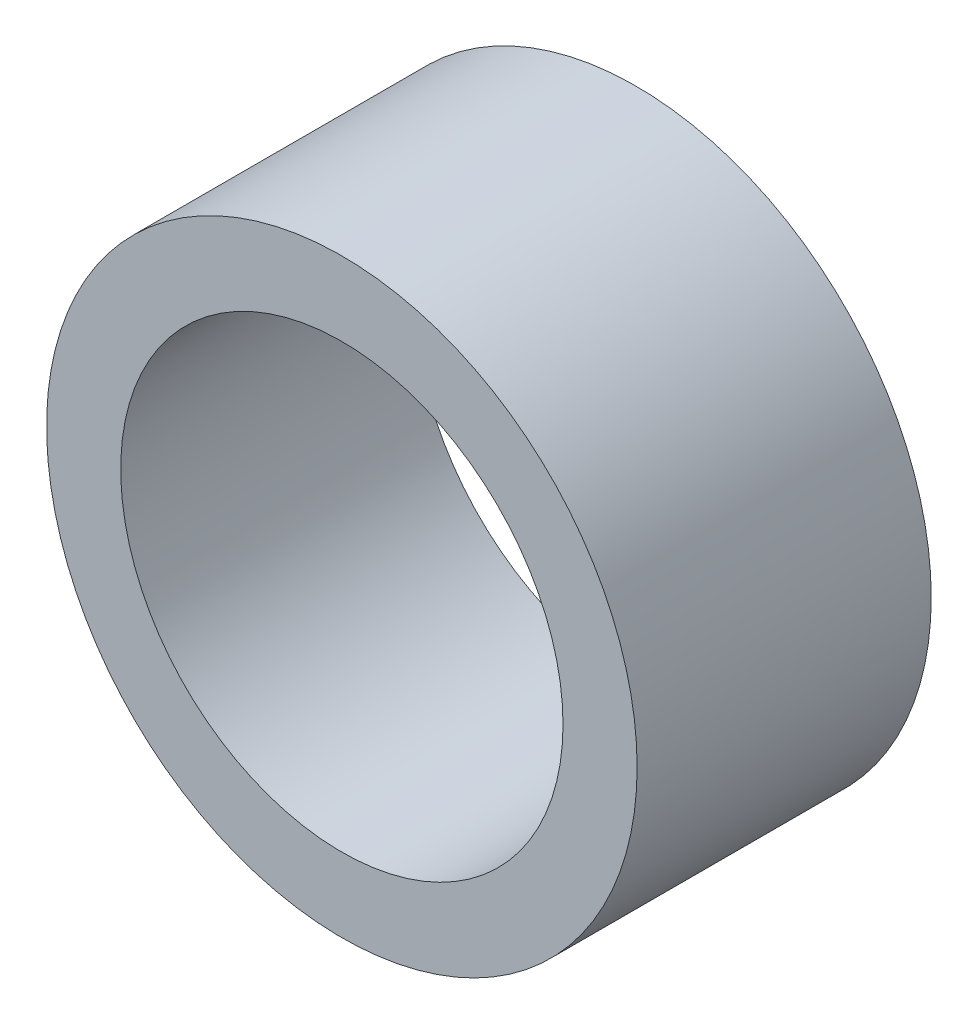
SolidWorks part; units mm, degrees
ref_plane "Front Plane" through (0, 0, 0) normal (0, 0, 1) x (1, 0, 0)
ref_plane "Top Plane" through (0, 0, 0) normal (0, 1, 0) x (1, 0, 0)
ref_plane "Right Plane" through (0, 0, 0) normal (1, 0, 0) x (0, 0, -1)
sketch "Sketch1" plane through (0, 0, 0) normal (0, 0, 1) x (1, 0, 0)
  circle A0 centre (0, 0) radius 6.3754
  circle A1 centre (0, 0) radius 4.7752
  dimension "OD" = 12.7508
  dimension "ID" = 9.5504
sketch "Sketch2" plane through (0, 0, 0) normal (1, 0, 0) x (0, 0, -1)
  line L2 (3.175, 0) -> (-3.175, 0) construction
  line L4 (-3.175, -6.3754) -> (-3.175, 6.3754) construction
  line L5 (-3.175, -4.7752) -> (3.175, -4.7752)
  line L6 (3.175, 4.7752) -> (-3.175, 4.7752)
  line L7 (3.175, -6.3754) -> (3.175, 6.3754) construction
  line L8 (-3.175, 6.3754) -> (3.175, 6.3754) construction
  line L9 (-3.175, -6.3754) -> (3.175, -6.3754) construction
  line L10 (0, 6.3754) -> (0, -6.3754) construction
  line L11 (0, 4.7752) -> (0, -4.7752) construction
  point P4 (0, -4.7752)
  point P7 (0, 4.7752)
  point P8 (0, 0)
  point P12 (-3.175, 0)
  point P15 (3.175, 0)
  point P16 (0, -6.3754)
  point P17 (0, 6.3754)
sketch "Sketch5" plane through (0, 0, 0) normal (0, 0, 1) x (1, 0, 0)
  circle A1 centre (0, 0) radius 4.7752
  circle A2 centre (0, 0) radius 4.7752
  circle A3 centre (0, 0) radius 6.3754
  circle A4 centre (0, 0) radius 6.3754
  dimension "D1" = 0
  dimension "D2" = 0
extrude "Boss-Extrude1" add sketch "Sketch5" along normal up to vertex (3.175 mm away) and the other way up to vertex (3.175 mm away)
sketch "Sketch4" plane through (0, 0, 3.175) normal (0, 0, 1) x (1, 0, 0)
  line L0 (0, 0) -> (-3.3766, 3.3766)
  line L2 (0, -6.3754) -> (0, 6.3754) construction
  circle A1 centre (0, 0) radius 4.7752 construction
  dimension "D1" = 45
equation "\"D1\"= \"Length@Sketch2\""
